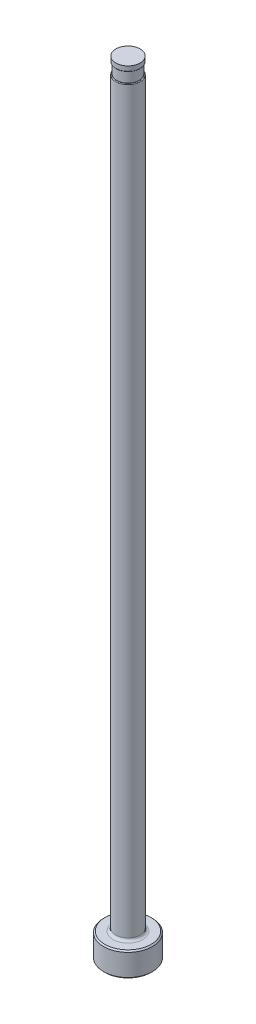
SolidWorks part; units mm, degrees
ref_plane "Front Plane" through (0, 0, 0) normal (0, 0, 1) x (1, 0, 0)
ref_plane "Top Plane" through (0, 0, 0) normal (0, 1, 0) x (1, 0, 0)
ref_plane "Right Plane" through (0, 0, 0) normal (1, 0, 0) x (0, 0, -1)
other "Configuration Table"
sketch "Sketch1" plane through (0, 0, 0) normal (0, 0, 1) x (1, 0, 0)
  line L0 (0, 259.9588) -> (0, -15.1925) construction
  line L1 (0, 0) -> (-4.7625, 0)
  line L2 (-4.7625, 0) -> (-4.7625, 4.7498)
  line L3 (-4.7625, 4.7498) -> (-2.3812, 4.7498)
  line L4 (-2.3812, 4.7498) -> (-2.3812, 152.4)
  line L5 (-2.3812, 152.4) -> (0, 152.4)
  line L6 (0, 152.4) -> (0, 0)
  dimension "L" = 152.4
  dimension "H" = 9.525
  dimension "T" = 4.7498
  dimension "D" = 4.7625
revolve "Revolve1" add sketch "Sketch1" angle 360 about L0
chamfer "Chamfer1" distance 0.254 angle 45 2 edges at (0, 4.7498, 4.7625) (0, 0, 4.7625)
fillet "Fillet1" radius 0.508 1 edges at (0, 4.7498, 2.3812)
sketch "Sketch2" plane through (0, 0, 0) normal (0, 0, 1) x (1, 0, 0)
  line L0 (-2.3812, 152.4) -> (-2.3812, 5.2578) construction
  line L1 (-2.3812, 151.384) -> (-2.178, 151.384)
  line L2 (-2.3812, 151.384) -> (-2.3812, 149.352)
  line L3 (-2.3812, 149.352) -> (-2.178, 149.352)
  line L4 (-2.178, 151.384) -> (-2.178, 149.352)
  line L5 (2.3812, 152.4) -> (-2.3812, 152.4) construction
  line L6 (0, 153.4483) -> (0, 147.3282) construction
  dimension "D1" = 2.032
  dimension "N" = 1.016
  dimension "FD" = 0.2032
  dimension "D3" = 4.3561
revolve "Vent Relief" cut sketch "Sketch2" angle 360 about L6
sketch "Sketch3" plane through (0, 0, 0) normal (0, 0, 1) x (1, 0, 0)
  line L0 (-2.178, 150.368) -> (-2.178, 86.868)
  line L1 (-2.178, 151.384) -> (-2.178, 149.352) construction
  line L2 (-2.3812, 149.352) -> (-2.3812, 5.2578) construction
  line L3 (-2.3812, 85.7504) -> (-2.3812, 150.368)
  line L4 (-2.3812, 150.368) -> (-2.178, 150.368)
  arc A0 (-2.178, 86.868) -> (-2.3812, 85.7504) centre (-5.353, 86.868) cw
  dimension "D1" = 3.175
  dimension "D2" = 63.5
extrude "D-Slot" cut sketch "Sketch3" against normal through all both and the other way through all
sketch "Sketch5" plane through (0, 0, 0) normal (0, 0, 1) x (1, 0, 0)
  line L0 (-2.3812, 151.384) -> (2.3812, 151.384) construction
  line L1 (-2.3812, 152.4) -> (-2.3762, 152.4)
  line L2 (-2.3812, 152.4) -> (-2.3812, 151.384)
  line L3 (-2.3812, 151.384) -> (-2.3762, 151.384)
  line L4 (-2.3762, 152.4) -> (-2.3762, 151.384)
  line L5 (0, 152.6877) -> (0, 150.5771) construction
  dimension "VP" = 0.0051
revolve "Vent Diameter" cut sketch "Sketch5" angle 360 about L5
fillet "Fillet2" radius 0.127 2 edges at (2.3812, 149.352, 0) (0, 151.384, 2.3762)
sketch "Pocket Sketch" plane through (0, 0, 0) normal (0, 0, 1) x (1, 0, 0)
  line L0 (-5.1594, 0) -> (-5.1594, 4.7752)
  line L1 (-5.1594, 4.7752) -> (-3.3417, 4.7752)
  line L2 (-2.5797, 5.5372) -> (-2.5797, 22.225)
  line L3 (-2.5797, 22.225) -> (0, 22.225)
  line L4 (0, 22.225) -> (0, 0)
  line L5 (0, 0) -> (-5.1594, 0)
  line L6 (0, 12.6104) -> (0, -2.4989) construction
  line L7 (-4.7625, 4.4958) -> (-4.7625, 0.254) construction
  line L8 (4.5085, 4.7498) -> (-4.5085, 4.7498) construction
  line L9 (-2.3812, 85.7504) -> (-2.3812, 5.2578) construction
  line L10 (-3.3417, 4.7752) -> (-2.5797, 5.5372)
  point P3 (-2.5797, 4.7752)
  dimension "D1" = 10.3187
  dimension "D2" = 0.3969
  dimension "D3" = 0.0254
  dimension "D4" = 0.1984
  dimension "D5" = 5.1594
  dimension "D6" = 22.225
